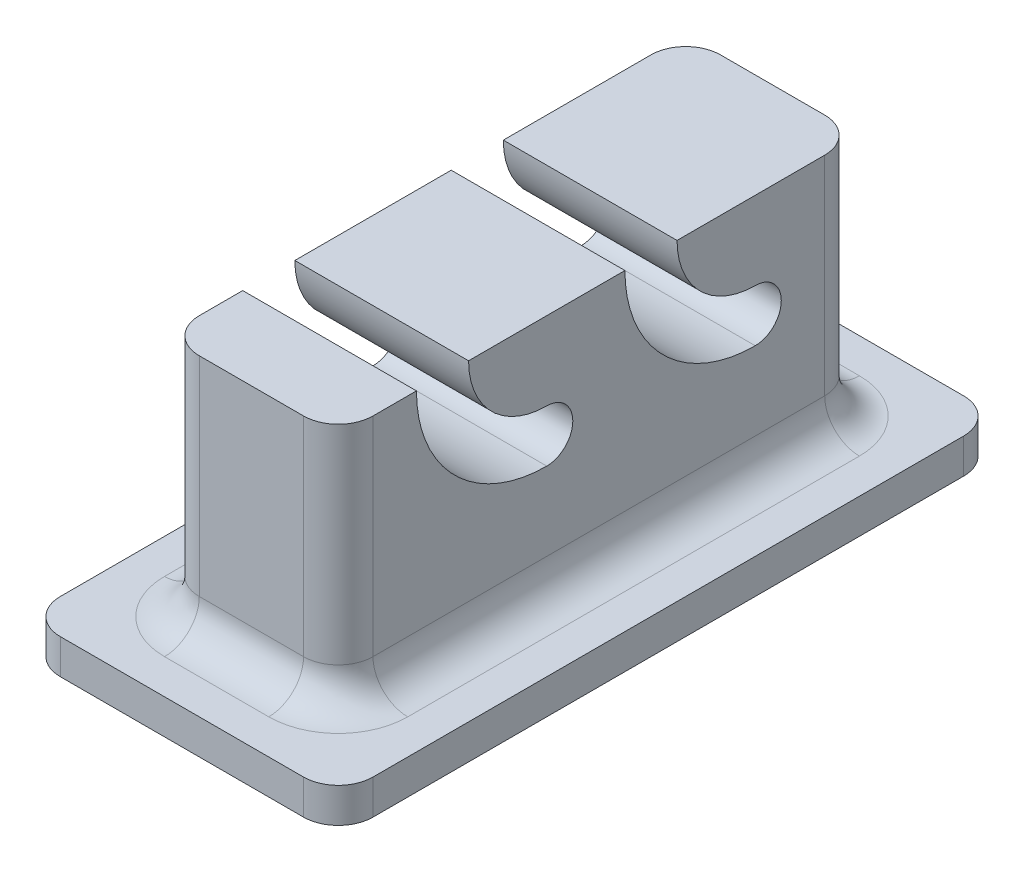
SolidWorks part; units mm, degrees
ref_plane "Front Plane" through (0, 0, 0) normal (0, 0, 1) x (1, 0, 0)
ref_plane "Top Plane" through (0, 0, 0) normal (0, 1, 0) x (1, 0, 0)
ref_plane "Right Plane" through (0, 0, 0) normal (1, 0, 0) x (0, 0, -1)
sketch "Sketch1" plane through (0, 0, 0) normal (0, 1, 0) x (1, 0, 0)
  line L1 (0, 0) -> (10, 0)
  line L2 (0, 0) -> (0, 30)
  line L3 (0, 30) -> (10, 30)
  line L4 (10, 0) -> (10, 30)
  dimension "D1" = 30
  dimension "D2" = 10
extrude "Boss-Extrude1" add sketch "Sketch1" along normal blind 16
sketch "Sketch3" plane through (0, 0, 0) normal (0, -1, 0) x (1, 0, 0)
  line L8 (-4, 4) -> (-4, -34)
  line L9 (-4, -34) -> (14, -34)
  line L10 (14, -34) -> (14, 4)
  line L11 (14, 4) -> (-4, 4)
  line L12 (-4, 4) -> (-4, -34)
  line L13 (-4, -34) -> (14, -34)
  line L14 (14, -34) -> (14, 4)
  line L15 (14, 4) -> (-4, 4)
  dimension "D1" = 4
extrude "Boss-Extrude2" add sketch "Sketch3" against normal blind 2
sketch "Sketch4" plane through (10, 0, 0) normal (1, 0, 0) x (0, 0, -1)
  line L0 (12, 10) -> (24, 10) construction
  line L1 (0, 16) -> (30, 16) construction
  line L2 (30, 16) -> (30, 2) construction
  line L3 (4.5, 16) -> (7.5, 16)
  line L4 (16.5, 16) -> (19.5, 16)
  line L5 (0, 16) -> (30, 16) construction
  circle A0 centre (12, 10) radius 1.5
  circle A1 centre (24, 10) radius 1.5
  arc A2 (12, 10) -> (6, 16) centre (12, 16) cw construction
  arc A3 (12, 11.5) -> (7.5, 16) centre (12, 16) cw
  arc A4 (12, 8.5) -> (4.5, 16) centre (12, 16) cw
  arc A5 (24, 10) -> (18, 16) centre (24, 16) cw construction
  arc A6 (24, 11.5) -> (19.5, 16) centre (24, 16) cw
  arc A7 (24, 8.5) -> (16.5, 16) centre (24, 16) cw
  point P23 (15, 16)
  dimension "D1" = 3
  dimension "D2" = 12
  dimension "D3" = 12
  dimension "D4" = 6
  dimension "D5" = 9
extrude "Cut-Extrude1" cut sketch "Sketch4" against normal blind 10 contours A4 A0 A3 M5 | A7 A1 A6 M5 | A1 | A0
fillet "Fillet1" radius 2 12 edges at (5, 2, 0) (-4, 1, 4) (0, 9, 0) (0, 2, -15) (0, 9, -30) (-4, 1, -34) (14, 1, 4) (14, 1, -34) (10, 2, -15) (5, 2, -30) (10, 9, -30) (10, 9, 0)
